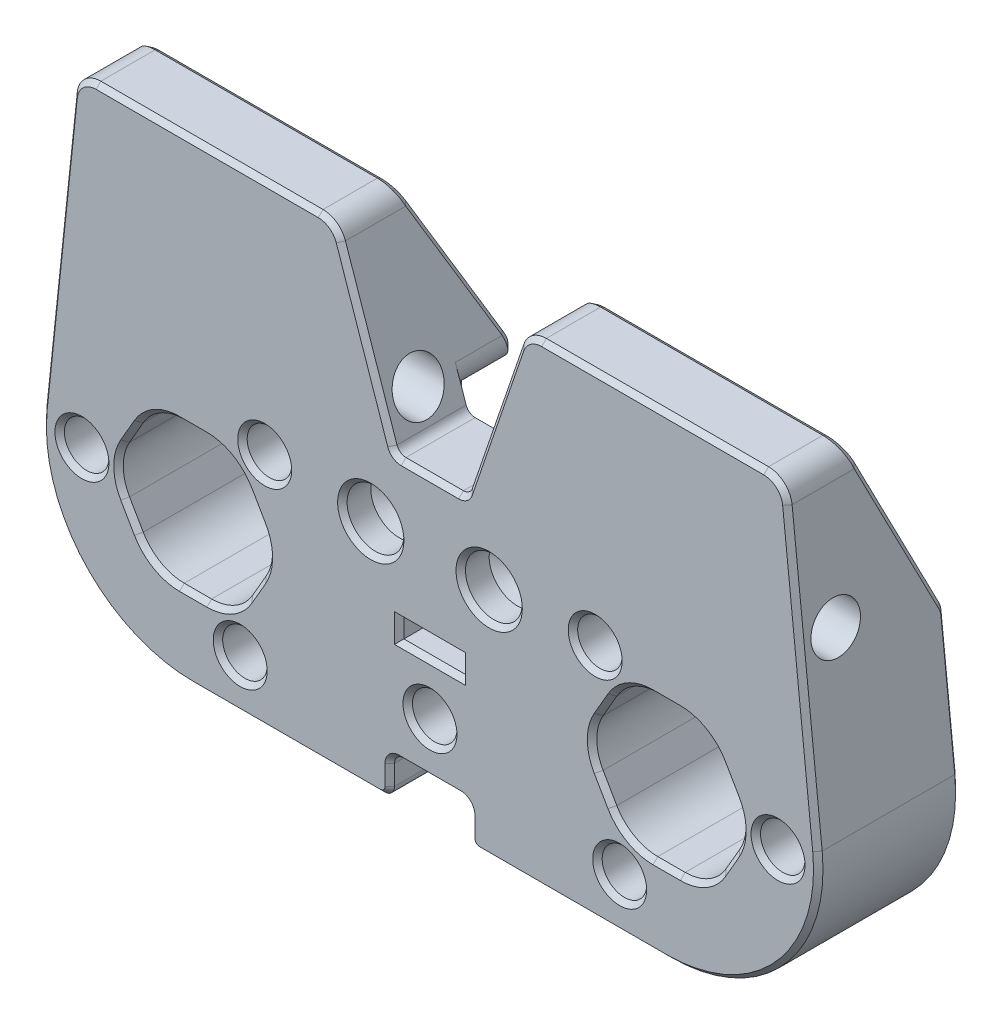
SolidWorks part; units mm, degrees
ref_plane "Płaszczyzna przednia" through (0, 0, 0) normal (0, 0, 1) x (1, 0, 0)
ref_plane "Płaszczyzna górna" through (0, 0, 0) normal (0, 1, 0) x (1, 0, 0)
ref_plane "Płaszczyzna prawa" through (0, 0, 0) normal (1, 0, 0) x (0, 0, -1)
sketch "Szkic1" plane through (0, 0, 0) normal (0, 0, 1) x (1, 0, 0)
  line L0 (25, 12.2819) -> (25, -8.7728) construction
  line L1 (4.3301, 7.5) -> (-4.3301, 7.5)
  line L2 (-4.3301, 7.5) -> (-8.6603, 0)
  line L3 (-8.6603, 0) -> (-4.3301, -7.5)
  line L4 (-4.3301, -7.5) -> (4.3301, -7.5)
  line L5 (4.3301, -7.5) -> (8.6603, 0)
  line L6 (8.6603, 0) -> (4.3301, 7.5)
  line L7 (41.3397, 0) -> (45.6699, 7.5)
  line L8 (45.6699, -7.5) -> (41.3397, 0)
  line L9 (54.3301, -7.5) -> (45.6699, -7.5)
  line L10 (58.6603, 0) -> (54.3301, -7.5)
  line L11 (54.3301, 7.5) -> (58.6603, 0)
  line L12 (45.6699, 7.5) -> (54.3301, 7.5)
  line L13 (0, 0) -> (50, 0) construction
  line L14 (22, 6.5) -> (28, 6.5) construction
  line L15 (22, 6.5) -> (22, -6.5) construction
  line L16 (22, -6.5) -> (28, -6.5) construction
  line L17 (28, 6.5) -> (28, -6.5) construction
  line L18 (0, 16) -> (50, 16)
  line L19 (0, -16) -> (50, -16)
  circle A0 centre (0, 0) radius 7.5 construction
  circle A1 centre (50, 0) radius 7.5 construction
  arc A2 (0, 16) -> (0, -16) centre (0, 0) ccw
  arc A3 (50, -16) -> (50, 16) centre (50, 0) ccw
  point P23 (25, 6.5)
  point P24 (22, 0)
  point P25 (25, 0)
  dimension "D1" = 15
  dimension "D2" = 50
  dimension "D3" = 6
  dimension "D4" = 13
  dimension "D5" = 32
extrude "Dodanie-wyciągnięcie1" add sketch "Szkic1" along normal blind 15
sketch "Szkic2" plane through (0, 0, 15) normal (0, 0, 1) x (1, 0, 0)
  line L0 (25, 16) -> (25, -16) construction
  line L1 (50, 16) -> (0, 16) construction
  line L2 (0, -16) -> (50, -16) construction
  line L3 (10.4299, -9.6705) -> (20.8592, -9.6705) construction
  line L4 (21.75, -1) -> (28.25, -1)
  line L5 (21.75, -1) -> (21.75, 1)
  line L6 (21.75, 1) -> (28.25, 1)
  line L7 (28.25, -1) -> (28.25, 1)
  line L12 (13.0068, -0.38) -> (13.0068, -13.38) construction
  line L13 (21.75, -11.88) -> (28.25, -11.88)
  line L14 (21.75, -11.88) -> (21.75, -16.26)
  line L15 (21.75, -16.26) -> (28.25, -16.26)
  line L16 (28.25, -11.88) -> (28.25, -16.26)
  line L17 (13.0068, -13.38) -> (13.0068, -14.76) construction
  arc A0 (50, -16) -> (50, 16) centre (50, 0) ccw construction
  point P10 (25, -1)
  point P11 (28.25, 0)
  point P15 (66, 0)
  point P24 (25, -11.88)
  dimension "D1" = 6.5
  dimension "D2" = 2
  dimension "D3" = 13
  dimension "D4" = 1.38
  dimension "D5" = 1.38
  dimension "D6" = 1.5
  dimension "D7" = 1.5
extrude "Wytnij-wyciągnięcie1" cut sketch "Szkic2" against normal through all
fillet "Zaokrąglenie1" radius 5 12 edges at (41.3397, 0, 7.5) (45.6699, 7.5, 7.5) (54.3301, 7.5, 7.5) (58.6603, 0, 7.5) (54.3301, -7.5, 7.5) (45.6699, -7.5, 7.5) (-4.3301, -7.5, 7.5) (-8.6603, 0, 7.5) (-4.3301, 7.5, 7.5) (4.3301, 7.5, 7.5) (8.6603, 0, 7.5) (4.3301, -7.5, 7.5)
sketch "Szkic3" plane through (0, 0, 0) normal (0, 0, -1) x (-1, 0, 0)
  line L0 (0, -16) -> (-21.75, -16) construction
  line L1 (-21.75, -11.88) -> (-20.75, -11.88)
  line L2 (-21.75, -11.88) -> (-21.75, -16)
  line L3 (-21.75, -16) -> (-20.75, -16)
  line L4 (-20.75, -11.88) -> (-20.75, -16)
  line L5 (-25, -11.88) -> (-25, -21.2725) construction
  line L6 (-28.25, -11.88) -> (-21.75, -11.88) construction
  line L7 (-29.25, -11.88) -> (-29.25, -16)
  line L8 (-28.25, -16) -> (-29.25, -16)
  line L9 (-28.25, -11.88) -> (-28.25, -16)
  line L10 (-28.25, -11.88) -> (-29.25, -11.88)
  dimension "D1" = 1
extrude "Wytnij-wyciągnięcie2" cut sketch "Szkic3" against normal through all
sketch "Szkic4" plane through (0, 0, 0) normal (0, 0, -1) x (-1, 0, 0)
  line L0 (-28.25, -1) -> (-28.25, 1) construction
  line L1 (-28.25, 3.4) -> (-21.75, 3.4)
  line L2 (-28.25, 3.4) -> (-28.25, 2.2)
  line L3 (-28.25, 2.2) -> (-21.75, 2.2)
  line L4 (-21.75, 3.4) -> (-21.75, 2.2)
  line L5 (-21.75, 1) -> (-21.75, -1) construction
  line L6 (-28.25, 1) -> (-21.75, 1) construction
  line L7 (-21.461, 3.8) -> (-8.8908, 3.8) construction
  line L8 (-21.75, 4.2) -> (-21.75, 5.4)
  line L9 (-28.25, 5.4) -> (-21.75, 5.4)
  line L10 (-28.25, 4.2) -> (-28.25, 5.4)
  line L11 (-28.25, 4.2) -> (-21.75, 4.2)
  line L12 (-22.9774, 5.8) -> (-9.2612, 5.8) construction
  line L13 (-28.25, 7.4) -> (-21.75, 7.4)
  line L14 (-28.25, 7.4) -> (-28.25, 6.2)
  line L15 (-28.25, 6.2) -> (-21.75, 6.2)
  line L16 (-21.75, 7.4) -> (-21.75, 6.2)
  line L17 (-21.75, 8.2) -> (-21.75, 9.4)
  line L18 (-28.25, 9.4) -> (-21.75, 9.4)
  line L19 (-28.25, 8.2) -> (-28.25, 9.4)
  line L20 (-28.25, 8.2) -> (-21.75, 8.2)
  line L21 (-20.7586, 9.8) -> (-9.8732, 9.8) construction
  line L22 (-28.25, 11.4) -> (-21.75, 11.4)
  line L23 (-28.25, 11.4) -> (-28.25, 10.2)
  line L24 (-28.25, 10.2) -> (-21.75, 10.2)
  line L25 (-21.75, 11.4) -> (-21.75, 10.2)
  line L26 (-21.75, 12.2) -> (-21.75, 13.4)
  line L27 (-28.25, 13.4) -> (-21.75, 13.4)
  line L28 (-28.25, 12.2) -> (-28.25, 13.4)
  line L29 (-28.25, 12.2) -> (-21.75, 12.2)
  line L30 (-28.25, 15.4) -> (-21.75, 15.4)
  line L31 (-28.25, 15.4) -> (-28.25, 14.2)
  line L32 (-28.25, 14.2) -> (-21.75, 14.2)
  line L33 (-21.75, 15.4) -> (-21.75, 14.2)
  dimension "D1" = 1.2
  dimension "D2" = 1.2
  dimension "D3" = 0.8
  dimension "D4" = 0.8
  dimension "D5" = 0.8
extrude "Wytnij-wyciągnięcie3" cut sketch "Szkic4" against normal blind 8
sketch "Szkic6" plane through (0, 0, 0) normal (0, 0, -1) x (-1, 0, 0)
  line L0 (-29.25, -11.88) -> (-20.75, -11.88) construction
  line L1 (-25, -1) -> (-25, -11.88) construction
  line L2 (-21.75, -1) -> (-28.25, -1) construction
  line L3 (0, 0) -> (-4.9658, -10.6491) construction
  line L9 (0, 0) -> (11.75, 0) construction
  line L10 (0, 0) -> (-7.5528, 9.001) construction
  circle A0 centre (-25, -6.44) radius 1.7
  circle A1 centre (-25, -6.44) radius 3 construction
  circle A4 centre (-7.5528, 9.001) radius 1.7
  circle A5 centre (11.75, 0) radius 1.7
  circle A6 centre (-7.5528, 9.001) radius 3 construction
  circle A7 centre (0, 0) radius 11.75 construction
  circle A8 centre (-61.75, 0) radius 1.7
  circle A9 centre (-42.4472, 9.001) radius 1.7
  circle A10 centre (-4.9658, -10.6491) radius 1.7
  circle A11 centre (-45.0342, -10.6491) radius 1.7
  point P5 (-25, -11.88)
  point P11 (-25, -6.44)
  dimension "D1" = 3.4
  dimension "D2" = 6
  dimension "D3" = 3.4
  dimension "D4" = 6
  dimension "D5" = 130
  dimension "D6" = 11.75
  dimension "D7" = 115
extrude "Wytnij-wyciągnięcie4" cut sketch "Szkic6" against normal through all
sketch "Szkic7" plane through (0, 0, 0) normal (0, 0, -1) x (-1, 0, 0)
  line L0 (-50, 16) -> (0, 16) construction
  line L1 (-28.25, 1) -> (-21.75, 1)
  line L2 (-28.25, 1) -> (-28.25, 16)
  line L3 (-28.25, 16) -> (-21.75, 16)
  line L4 (-21.75, 1) -> (-21.75, 16)
  line L5 (-21.75, 14.2) -> (-21.75, 15.4) construction
extrude "Wytnij-wyciągnięcie5" cut sketch "Szkic7" against normal blind 7.2
sketch "Szkic8" plane through (0, 0, 0) normal (0, 0, -1) x (-1, 0, 0)
  line L0 (-31.25, 8.5) -> (-18.75, 8.5) construction
  line L1 (-21.75, 16) -> (-28.25, 16) construction
  line L2 (-28.25, -1) -> (-28.25, 16) construction
  line L3 (-25, 16) -> (-25, 1) construction
  line L4 (-28.25, 1) -> (-21.75, 1) construction
  circle A0 centre (-31.25, 8.5) radius 1.7
  circle A1 centre (-18.75, 8.5) radius 1.7
  circle A2 centre (-31.25, 8.5) radius 3 construction
  point P2 (-25, 8.5)
  point P5 (-25, 16)
  point P15 (-25, 8.5)
  dimension "D1" = 3.4
  dimension "D2" = 6
extrude "Wytnij-wyciągnięcie6" cut sketch "Szkic8" against normal through all
sketch "Szkic9" plane through (0, 0, 0) normal (0, 0, -1) x (-1, 0, 0)
  line L0 (-36.15, 16) -> (-36.15, 7.85)
  line L1 (-36.15, 7.85) -> (-30.65, 3.235)
  line L2 (-30.65, 3.235) -> (-30.65, -1)
  line L3 (-30.65, -1) -> (-19.35, -1)
  line L4 (-21.75, -1) -> (-28.25, -1) construction
  line L5 (-50, 16) -> (-28.25, 16) construction
  line L7 (-36.15, 16) -> (-13.85, 16)
  line L8 (-21.75, 16) -> (-28.25, 16) construction
  line L9 (-25, 16) -> (-25, -1) construction
  line L10 (-19.35, 3.235) -> (-19.35, -1)
  line L11 (-13.85, 7.85) -> (-19.35, 3.235)
  line L12 (-13.85, 16) -> (-13.85, 7.85)
  circle A0 centre (-31.25, 8.5) radius 2.35 construction
  circle A1 centre (-18.75, 8.5) radius 2.35 construction
  point P8 (-25, -1)
  dimension "D2" = 4.7
  dimension "D1" = 130
  dimension "D3" = 22.3
  dimension "D4" = 11.3
  dimension "D5" = 1.2976
  dimension "D6" = 8.15
extrude "Wytnij-wyciągnięcie7" cut sketch "Szkic9" against normal up to surface (7.2 mm away)
fillet "Zaokrąglenie2" radius 1 1 edges at (25, 1, 7.2)
fillet "Zaokrąglenie3" radius 1 12 edges at (13.85, 16, 3.6) (36.15, 16, 3.6) (36.15, 7.85, 3.6) (13.85, 7.85, 3.6) (19.35, 3.235, 3.6) (30.65, 3.235, 3.6) (30.65, -1, 3.6) (19.35, -1, 3.6) (29.25, -16, 7.5) (29.25, -11.88, 7.5) (20.75, -11.88, 7.5) (20.75, -16, 7.5)
hole_wizard "Otwór Ø6.0 (6)1" positions "Szkic12" profile "Szkic13" hole size "Ø6.0" standard "DIN"
sketch "Szkic12" plane through (0, 0, 15) normal (0, 0, 1) x (1, 0, 0)
  point P0 (18.75, 8.5)
  point P3 (31.25, 8.5)
sketch "Szkic13" plane through (18.75, 8.5, 15) normal (1, 0, 0) x (0, -1, 0)
  line L0 (0, 0) -> (0, 4.8026)
  line L1 (0, 4.8026) -> (3, 3)
  line L2 (3, 3) -> (3, 0)
  line L5 (3, 0) -> (0, 0)
  line L10 (0, 4.8026) -> (-3, 3) construction
  line L11 (0, -6.35) -> (0, 107.95) construction
  dimension "Średnica otworu" = 6
  dimension "Głębokość otworu" = 3
  dimension "Kąt wiertła" = 118
hole_wizard "Otwór Ø4.7 (4.7)1" positions "Szkic14" profile "Szkic15" hole size "Ø4.7" standard "DIN"
sketch "Szkic14" plane through (0, 0, 15) normal (0, 0, 1) x (1, 0, 0)
  point P0 (7.5528, 9.001)
  point P3 (-11.75, 0)
  point P6 (25, -6.44)
  point P9 (42.4472, 9.001)
  point P12 (61.75, 0)
  point P15 (4.9658, -10.6491)
  point P18 (45.0342, -10.6491)
sketch "Szkic15" plane through (7.5528, 9.001, 15) normal (1, 0, 0) x (0, -1, 0)
  line L0 (0, 0) -> (0, 6.912)
  line L1 (0, 6.912) -> (2.35, 5.5)
  line L2 (2.35, 5.5) -> (2.35, 0)
  line L5 (2.35, 0) -> (0, 0)
  line L10 (0, 6.912) -> (-2.35, 5.5) construction
  line L11 (0, -6.35) -> (0, 107.95) construction
  dimension "Średnica otworu" = 4.7
  dimension "Głębokość otworu" = 5.5
  dimension "Kąt wiertła" = 118
sketch "Szkic16" plane through (0, 0, 0) normal (0, 0, -1) x (-1, 0, 0)
  line L0 (-50, -16) -> (-30.25, -16) construction
  line L1 (0, -16) -> (-19.75, -16) construction
  line L3 (-50, 0) -> (107.775, 0) construction
  line L4 (-62.5, -34) -> (-30.25, -34) construction
  line L5 (-62.5, -34) -> (-65.9116, -1.6796) construction
  line L6 (12.5, -34) -> (15.9116, -1.6796) construction
  line L7 (-30.25, -16) -> (-30.25, -34) construction
  line L8 (-19.75, -16) -> (-19.75, -34) construction
  line L9 (-19.75, -34) -> (12.5, -34) construction
  line L10 (-19.75, 34) -> (12.5, 34)
  line L11 (-19.75, 16) -> (-19.75, 34)
  line L12 (-30.25, 16) -> (-30.25, 34)
  line L13 (12.5, 34) -> (15.9116, 1.6796)
  line L14 (-62.5, 34) -> (-65.9116, 1.6796)
  line L15 (-62.5, 34) -> (-30.25, 34)
  line L16 (0, 16) -> (-19.75, 16)
  line L17 (-50, 16) -> (-30.25, 16)
  arc A0 (0, -16) -> (0, 16) centre (0, 0) ccw construction
  arc A1 (-50, 16) -> (-50, -16) centre (-50, 0) ccw construction
  arc A2 (0, -16) -> (15.9116, -1.6796) centre (0, 0) ccw construction
  arc A3 (-65.9116, -1.6796) -> (-50, -16) centre (-50, 0) ccw construction
  arc A4 (-65.9116, 1.6796) -> (-50, 16) centre (-50, 0) cw
  arc A5 (0, 16) -> (15.9116, 1.6796) centre (0, 0) cw
  dimension "D1" = 18
  dimension "D2" = 75
extrude "Dodanie-wyciągnięcie2" add sketch "Szkic16" against normal up to surface (15 mm away)
sketch "Szkic18" plane through (19.75, 0, 0) normal (1, 0, 0) x (0, 0, -1)
  line L0 (0, 34) -> (0, 15.8738)
  line L1 (0, 34) -> (0, 16) construction
  line L2 (0, 15.8738) -> (-8.4524, 34)
  line L3 (-15, 34) -> (0, 34) construction
  line L4 (-8.4524, 34) -> (0, 34)
  dimension "D1" = 65
  dimension "D2" = 20
extrude "Wytnij-wyciągnięcie8" cut sketch "Szkic18" against normal through all both and the other way through all
sketch "Szkic19" plane through (0, 2.8352, -6.08) normal (0, 0.4226, -0.9063) x (-1, 0, 0)
  line L0 (-50, 22.3866) -> (0, 22.3866) construction
  line L1 (-30.25, 20.8402) -> (-19.75, 20.8402) construction
  line L2 (12.5, 34.3866) -> (-19.75, 34.3866) construction
  circle A0 centre (-50, 22.3866) radius 6
  circle A1 centre (0, 22.3866) radius 6
  point P4 (-25, 20.8402)
  point P5 (-25, 22.3866)
  dimension "D3" = 12
  dimension "D1" = 50
  dimension "D2" = 12
extrude "Wytnij-wyciągnięcie9" cut sketch "Szkic19" against normal blind 4
sketch "Szkic20" plane through (0, 0, 0) normal (0, 0, -1) x (-1, 0, 0)
  line L0 (-34.1389, 34) -> (-36.1555, 14.895)
  line L1 (-30.25, 34) -> (-62.5, 34) construction
  line L2 (-62.5, 34) -> (-64.4133, 15.8738) construction
  line L3 (-25, 16) -> (-25, 40.8327) construction
  line L4 (-19.75, 16) -> (-30.25, 16) construction
  line L5 (-15.8611, 34) -> (-13.8445, 14.895)
  line L6 (-34.1389, 34) -> (-15.8611, 34)
  line L7 (-13.8445, 14.895) -> (-36.1555, 14.895)
  arc A0 (-36.15, 15) -> (-36.6638, 15.8738) centre (-37.15, 15) ccw construction
  arc A1 (-36.15, 15) -> (-37.15, 16) centre (-37.15, 15) ccw construction
extrude "Wytnij-wyciągnięcie13" cut sketch "Szkic20" against normal through all
sketch "Szkic21" plane through (0, 0, 7.2) normal (0, 0, -1) x (-1, 0, 0)
  line L2 (-36.15, 14.9474) -> (-36.0389, 16)
  line L3 (-36.0389, 16) -> (-37.15, 16)
  line L4 (-36.15, 14.9474) -> (-36.0389, 16)
  line L5 (-36.0389, 16) -> (-37.15, 16)
  line L6 (-12.85, 16) -> (-13.9611, 16)
  line L7 (-13.9611, 16) -> (-13.85, 14.9474)
  line L8 (-12.85, 16) -> (-13.9611, 16)
  line L9 (-13.9611, 16) -> (-13.85, 14.9474)
  line L11 (-36.15, 15) -> (-36.15, 14.9474)
  line L12 (-36.15, 15) -> (-36.15, 14.9474)
  line L13 (-13.85, 14.9474) -> (-13.85, 15)
  line L14 (-13.85, 14.9474) -> (-13.85, 15)
  arc A1 (-36.15, 15) -> (-37.15, 16) centre (-37.15, 15) ccw
  arc A2 (-36.15, 15) -> (-37.15, 16) centre (-37.15, 15) ccw
  arc A3 (-12.85, 16) -> (-13.85, 15) centre (-12.85, 15) ccw
  arc A4 (-12.85, 16) -> (-13.85, 15) centre (-12.85, 15) ccw
  dimension "D1" = 0
  dimension "D2" = 0
extrude "Dodanie-wyciągnięcie3" add sketch "Szkic21" along normal up to surface (7.2 mm away)
sketch "Szkic23" plane through (36.15, 0, 0) normal (-1, 0, 0) x (0, 0, 1)
  line L0 (0, 15.8738) -> (0.0588, 16)
  line L1 (0.0588, 16) -> (0, 16)
  line L2 (0, 16) -> (0, 15.8738)
extrude "Wytnij-wyciągnięcie14" cut sketch "Szkic23" against normal through all both and the other way through all
sketch "Szkic24" plane through (0, 0, 15) normal (0, 0, 1) x (1, 0, 0)
  line L0 (13.8445, 14.895) -> (13.8445, 34)
  line L1 (-12.5, 34) -> (15.8611, 34) construction
  line L2 (13.8445, 34) -> (36.1555, 34)
  line L3 (34.1389, 34) -> (62.5, 34) construction
  line L4 (36.1555, 34) -> (36.1555, 14.895)
  line L5 (36.1555, 14.895) -> (13.8445, 14.895)
extrude "Wytnij-wyciągnięcie15" cut sketch "Szkic24" against normal through all
fillet "Zaokrąglenie5" radius 2 1 edges at (50.2844, 15.8738, 0)
chamfer "Sfazowanie2" distance 0.25 angle 45 2 edges at (50, 28.5622, 5.9167) (0, 28.5622, 5.9167)
chamfer "Sfazowanie3" distance 0.5 angle 45 31 edges at (43.5048, -3.75, 0) (46.0566, -6.8301, 0) (42.1132, 0, 0) (50, -7.5, 0) (43.5048, 3.75, 0) (53.9434, -6.8301, 0) (46.0566, 6.8301, 0) (56.4952, -3.75, 0) (50, 7.5, 0) (57.8868, 0, 0) (53.9434, 6.8301, 0) (56.4952, 3.75, 0) (63.45, 0, 0) (44.1472, 9.001, 0) (46.7342, -10.6491, 0) (-6.4952, 3.75, 0) (-7.8868, 0, 0) (-3.9434, 6.8301, 0) (-6.4952, -3.75, 0) (0, 7.5, 0) (-3.9434, -6.8301, 0) (3.9434, 6.8301, 0) (0, -7.5, 0) (6.4952, 3.75, 0) (3.9434, -6.8301, 0) (7.8868, 0, 0) (6.4952, -3.75, 0) (-13.45, 0, 0) (5.8528, 9.001, 0) (23.3, -6.44, 0) (3.2658, -10.6491, 0)
sketch "Szkic28" plane through (36.1555, 0, 0) normal (-1, 0, 0) x (0, 0, 1)
  line L5 (8.4524, 34) -> (0.1874, 16.2757)
  line L6 (0, 15.4305) -> (0, 14.895)
  line L7 (0, 14.895) -> (15, 14.895)
  line L8 (15, 14.895) -> (15, 34)
  line L9 (15, 34) -> (8.4524, 34)
  line L10 (8.4524, 34) -> (0.1874, 16.2757)
  line L11 (0, 15.4305) -> (0, 14.895)
  line L12 (0, 14.895) -> (15, 14.895)
  line L13 (15, 14.895) -> (15, 34)
  line L14 (15, 34) -> (8.4524, 34)
  arc A1 (0.1874, 16.2757) -> (0, 15.4305) centre (2, 15.4305) ccw
  arc A2 (0.1874, 16.2757) -> (0, 15.4305) centre (2, 15.4305) ccw
  dimension "D1" = 0
extrude "Dodanie-wyciągnięcie4" add sketch "Szkic28" along normal up to surface (22.311 mm away)
sketch "Szkic30" plane through (0, 0, 0) normal (0, 0, -1) x (-1, 0, 0)
  line L1 (-36.15, 14.895) -> (-13.85, 14.895)
  line L2 (-36.15, 14.895) -> (-36.15, 16.395)
  line L3 (-36.15, 16.395) -> (-13.85, 16.395)
  line L4 (-13.85, 14.895) -> (-13.85, 16.395)
  line L5 (-13.85, 14.895) -> (-21.75, 14.895) construction
  line L6 (-13.85, 8.3163) -> (-13.85, 14.895) construction
  dimension "D1" = 1.5
extrude "Wytnij-wyciągnięcie17" cut sketch "Szkic30" against normal up to surface (7.2 mm away)
sketch "Szkic31" plane through (0, 0, 0) normal (0, 0, -1) x (-1, 0, 0)
  line L0 (-35, 34) -> (-15, 34)
  line L1 (-15, 34) -> (-21.25, 15.695)
  line L3 (-21.25, 15.695) -> (-28.75, 15.695)
  line L4 (-28.75, 15.695) -> (-35, 34)
  line L5 (-25, 14.895) -> (-25, 15.695) construction
  line L6 (-21.75, 14.895) -> (-28.25, 14.895) construction
  line L7 (-25, 14.2) -> (-25, 13.4) construction
  line L8 (-28.25, 14.2) -> (-21.75, 14.2) construction
  line L9 (-21.75, 13.4) -> (-28.25, 13.4) construction
  line L10 (-25, 15.695) -> (-25, 34) construction
  line L11 (12.5, 34) -> (-62.5, 34) construction
  dimension "D1" = 7.5
  dimension "D2" = 20
extrude "Wytnij-wyciągnięcie18" cut sketch "Szkic31" against normal through all
sketch "Szkic26" plane through (0, 0, 0) normal (1, 0, 0) x (0, 0, -1)
  circle A0 centre (-11.1898, 19.5212) radius 2.6
  dimension "D3" = 5.2
  dimension "D1" = 19.5212
  dimension "D2" = 11.1898
extrude "Wytnij-wyciągnięcie16" cut sketch "Szkic26" against normal through all both and the other way through all
fillet "Zaokrąglenie6" radius 1 4 edges at (13.85, 16.395, 3.7215) (36.15, 16.395, 3.7215) (21.25, 15.695, 11.1) (28.75, 15.695, 11.1)
fillet "Zaokrąglenie7" radius 2.5 6 edges at (28.989, 16.395, 3.7215) (21.011, 16.395, 3.7215) (-12.5, 34, 11.7262) (15, 34, 11.7262) (35, 34, 11.7262) (62.5, 34, 11.7262)
chamfer "Sfazowanie4" distance 0.5 angle 45 124 edges at (56.4952, -3.75, 15) (50, -7.5, 15) (-6.4952, -3.75, 15) (0, -7.5, 15) (-6.4952, 3.75, 15) (0, 7.5, 15) (0.0027, 16.2757, 0.1874) (50.3047, 15.4305, 0) (6.4952, 3.75, 15) (6.4952, -3.75, 15) (42.1132, 0, 15) (18.2983, 24.3399, 15) (25, 15.695, 15) (46.0566, 6.8301, 15) (36.15, 11.8557, 0) (33.8172, 16.395, 0.243) (35.15, 16.395, 3.7215) (21.3835, 15.8817, 15) (53.9434, 6.8301, 15) (28.6165, 15.8817, 15) (14.6057, 16.3647, 0.2289) (14.1065, 16.0638, 0.1029) (13.8502, 15.4127, 0) (36.1498, 15.4127, 0) (35.9392, 16.0092, 0.0856) (35.3943, 16.3647, 0.2289) (57.8868, 0, 15) (53.9434, -6.8301, 15) (46.0566, -6.8301, 15) (32.2703, 26.0053, 4.7244) (-3.9434, -6.8301, 15) (48.5191, 34, 8.4524) (63.5535, 24.0191, 3.7982) (61.9224, 33.3582, 8.1531) (35.3337, 33.5334, 8.2348) (30.4509, 17.4406, 0.7306) (31.7017, 24.3399, 15) (34.4222, 32.3078, 11.3316) (30.1184, 19.7028, 4.4927) (16.1828, 16.395, 0.243) (17.5157, 16.395, 3.7215) (17.7297, 26.0053, 4.7244) (15.5778, 32.3078, 11.3316) (-7.8868, 0, 15) (1.4809, 34, 8.4524) (14.6663, 33.5334, 8.2348) (-11.9224, 33.3582, 8.1531) (19.5491, 17.4406, 0.7306) (-12.7362, 31.7624, 11.2045) (1.4809, 34, 15) (13.2119, 34, 11.7262) (-10.25, 34, 11.7262) (64.3239, 16.721, 15) (48.5191, 34, 15) (-3.9434, 6.8301, 15) (61.9224, 33.3582, 15) (35.3337, 33.5334, 15) (14.6663, 33.5334, 15) (-11.9224, 33.3582, 15) (60.25, 34, 11.7262) (36.7881, 34, 11.7262) (62.7362, 31.7624, 11.2045) (3.9434, 6.8301, 15) (7.8868, 0, 15) (3.9434, -6.8301, 15) (61.8927, -10.7034, 15) (61.8927, -10.7034, 0) (33.4, 5.5425, 0) (40.125, -16, 0) (29.25, -13.94, 0) (25, -11.88, 0) (20.75, -13.94, 0) (13.85, 11.8557, 0) (16.6, 5.5425, 0) (19.35, 1.3843, 0) (25, -1, 0) (30.65, 1.3843, 0) (20.4571, -15.7071, 0) (29.5429, -15.7071, 0) (30.7437, 3.1913, 0) (19.2563, 3.1913, 0) (9.875, -16, 0) (40.125, -16, 15) (29.25, -13.94, 15) (20.75, -13.94, 15) (25, -11.88, 15) (20.4571, -15.7071, 15) (29.5429, -15.7071, 15) (36.0563, 7.8937, 0) (13.9437, 7.8937, 0) (30.3571, -0.7071, 0) (19.6429, -0.7071, 0) (28.9571, -12.1729, 0) (28.9571, -12.1729, 15) (21.0429, -12.1729, 0) (21.0429, -12.1729, 15) (21.75, 0, 15) (25, -1, 15) (34.25, 8.5, 15) (28.25, 0, 15) (25, 1, 15) (21.75, 8.5, 15) (47.3842, -10.6491, 15) (7.3158, -10.6491, 15) (64.1, 0, 15) (44.7972, 9.001, 15) (27.35, -6.44, 15) (-9.4, 0, 15) (9.9028, 9.001, 15) (-11.8927, -10.7034, 0) (-11.8927, -10.7034, 15) (-15.1859, 8.555, 0) (-14.3239, 16.721, 15) (9.875, -16, 15) (43.5048, 3.75, 15) (43.5048, -3.75, 15) (50, 7.5, 15) (65.1859, 8.555, 0) (-0.3047, 15.4305, 0) (-13.5535, 24.0191, 3.7982) (49.9973, 16.2757, 0.1874) (-14.4144, 15.8633, 0.0474) (64.4144, 15.8633, 0.0474) (56.4952, 3.75, 15)
